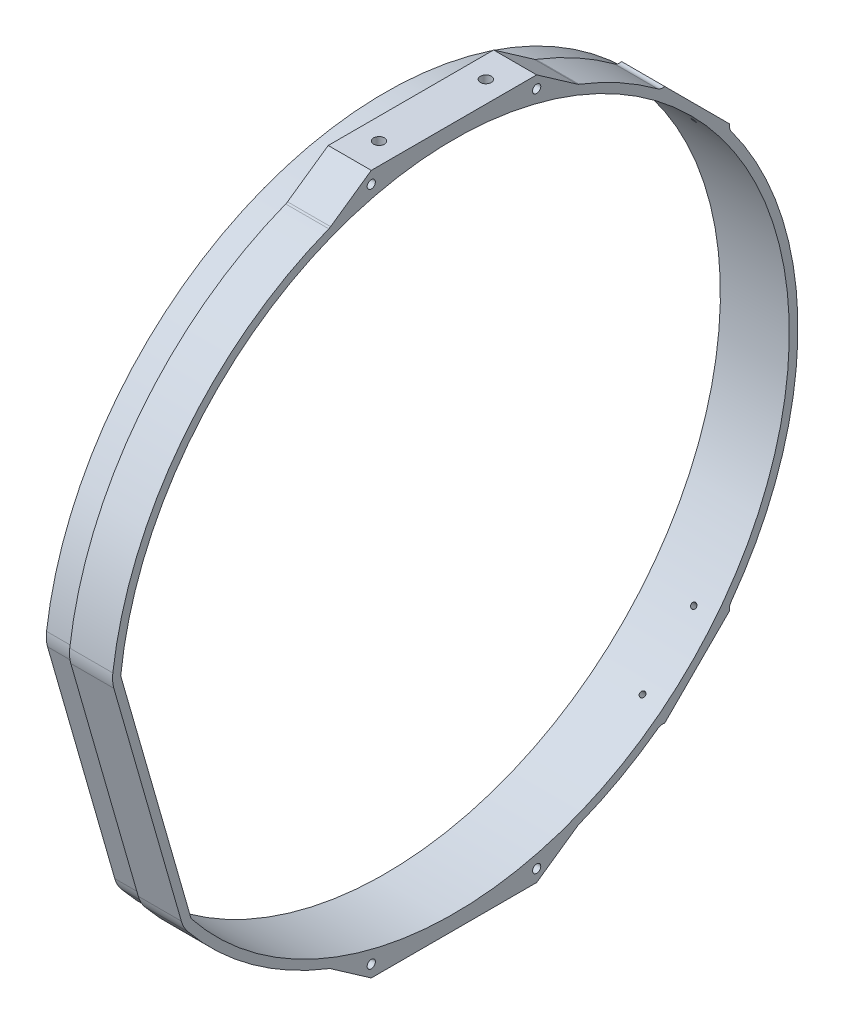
SolidWorks part; units mm, degrees
ref_plane "Front Plane" through (0, 0, 0) normal (0, 0, 1) x (1, 0, 0)
ref_plane "Top Plane" through (0, 0, 0) normal (0, 1, 0) x (1, 0, 0)
ref_plane "Right Plane" through (0, 0, 0) normal (1, 0, 0) x (0, 0, -1)
ref_plane "Plane1" through (0, 0, 0) normal (-1, 0, 0) x (0, -1, 0)
sketch "Sketch1" plane through (0, 0, 0) normal (-1, 0, 0) x (0, -1, 0)
  line L0 (-406, 0) -> (406, 0) construction
  line L1 (-320.0648, -244.6307) -> (-244.6307, -320.0648)
  line L2 (372.3363, -144.2434) -> (406, -96)
  line L3 (406, -96) -> (406, 96)
  line L4 (406, 96) -> (372.3363, 144.2434)
  line L5 (-372.3363, 144.2434) -> (-406, 96)
  line L6 (-406, 96) -> (-406, -96)
  line L7 (-406, -96) -> (-372.3363, -144.2434)
  line L8 (320.0648, -244.6307) -> (244.6307, -320.0648)
  line L9 (0, 0) -> (-282.3477, -282.3477) construction
  line L10 (0, 0) -> (282.3477, -282.3477) construction
  line L11 (0, 0) -> (99.2294, 346.0542) construction
  line L12 (246.3048, 314.284) -> (-42.3331, 397.0496)
  line L13 (241.6601, 305.2129) -> (-43.2012, 386.8955)
  line L14 (0, 0) -> (0, 450) construction
  arc A0 (320.0648, -244.6307) -> (321.7521, -236.4658) centre (329.81, -242.3878) cw
  arc A1 (321.7521, -236.4658) -> (372.3363, -144.2434) centre (0, 0) ccw
  arc A2 (372.3363, 144.2434) -> (246.3048, 314.284) centre (0, 0) ccw
  arc A3 (-372.3363, -144.2434) -> (-321.7521, -236.4658) centre (0, 0) ccw
  arc A4 (-321.7521, -236.4658) -> (-320.0648, -244.6307) centre (-329.81, -242.3878) cw
  arc A5 (-236.4658, -321.7521) -> (236.4658, -321.7521) centre (0, 0) ccw
  arc A6 (236.4658, -321.7521) -> (244.6307, -320.0648) centre (242.3878, -329.81) cw
  arc A7 (-244.6307, -320.0648) -> (-236.4658, -321.7521) centre (-242.3878, -329.81) cw
  arc A8 (-43.2012, 386.8955) -> (241.6601, 305.2129) centre (0, 0) ccw
  arc A9 (-42.3331, 397.0496) -> (-372.3363, 144.2434) centre (0, 0) ccw
  dimension "D9" = 10
  dimension "D8" = 399.3
  dimension "D10" = 10
  dimension "D17" = 399.3
  dimension "D18" = 10
  dimension "D19" = 10
  dimension "D20" = 10
  dimension "D1" = 812
  dimension "D2" = 192
  dimension "D3" = 192
  dimension "D4" = 145.093
  dimension "D5" = 145.093
  dimension "D6" = 145.093
  dimension "D7" = 145.093
  dimension "D11" = 106.68
  dimension "D12" = 106.68
  dimension "D13" = 45
  dimension "D14" = 45
  dimension "D15" = 399.3
  dimension "D16" = 399.3
  dimension "D21" = 450
  dimension "D22" = 16
  dimension "D23" = 10
  dimension "D24" = 360
extrude "Extrude1" add sketch "Sketch1" against normal blind 50
sketch "Sketch50" plane through (0, 282.3477, -282.3477) normal (0, 0.7071, -0.7071) x (1, 0, 0)
  line L0 (25, 53.34) -> (25, -53.34) construction
  line L1 (50, 53.34) -> (0, 53.34) construction
  line L2 (50, -53.34) -> (0, -53.34) construction
  line L3 (0, 0) -> (50, 0) construction
  line L4 (50, -53.34) -> (50, 53.34) construction
  circle A0 centre (25, 42) radius 3.175
  circle A1 centre (25, -42) radius 3.175
  dimension "D1" = 6.35
  dimension "D2" = 84
  dimension "D3" = 42
extrude "Extrude4" cut sketch "Sketch50" against normal blind 30
sketch "Sketch51" plane through (0, -282.3477, -282.3477) normal (0, -0.7071, -0.7071) x (1, 0, 0)
  line L0 (25, 53.34) -> (25, -53.34) construction
  line L1 (50, 53.34) -> (0, 53.34) construction
  line L2 (50, -53.34) -> (0, -53.34) construction
  line L3 (0, 0) -> (50, 0) construction
  line L4 (50, -53.34) -> (50, 53.34) construction
  circle A0 centre (25, 42) radius 3.175
  circle A1 centre (25, -42) radius 3.175
  dimension "D1" = 6.35
  dimension "D2" = 84
  dimension "D3" = 42
extrude "Extrude5" cut sketch "Sketch51" against normal blind 30
sketch "Sketch52" plane through (0, 0, 0) normal (-1, 0, 0) x (0, 0, 1)
  line L0 (305.2129, -241.6601) -> (386.8955, 43.2012) construction
  line L1 (305.2129, -241.6601) -> (386.8955, 43.2012)
  line L2 (311.5619, -244.9139) -> (394.0041, 42.5961)
  arc A1 (386.8955, 43.2012) -> (305.2129, -241.6601) centre (0, 0) ccw construction
  arc A2 (394.0041, 42.5961) -> (311.5619, -244.9139) centre (0, 0) ccw
  arc A3 (386.8955, 43.2012) -> (305.2129, -241.6601) centre (0, 0) ccw
  dimension "D1" = 7
extrude "Extrude6" add sketch "Sketch52" along normal blind 30
sketch "Sketch53" plane through (50, 0, 0) normal (1, 0, 0) x (0, 0, -1)
  line L0 (-96, 392) -> (96, 392) construction
  line L1 (-96, 406) -> (96, 406) construction
  line L2 (0, 406) -> (0, 389.3) construction
  line L3 (-96, -392) -> (96, -392) construction
  line L4 (0, -406) -> (0, -389.3) construction
  line L5 (96, -406) -> (-96, -406) construction
  circle A0 centre (-96, 392) radius 4.763
  circle A1 centre (96, 392) radius 4.763
  circle A2 centre (0, 0) radius 389.3 construction
  circle A3 centre (-96, -392) radius 4.763
  circle A4 centre (96, -392) radius 4.763
  dimension "D2" = 9.526
  dimension "D1" = 14
  dimension "D3" = 96
  dimension "D4" = 192
  dimension "D5" = 192
  dimension "D6" = 96
  dimension "D7" = 14
extrude "Extrude7" cut sketch "Sketch53" against normal through all
sketch "Sketch54" plane through (0, 406, 0) normal (0, 1, 0) x (1, 0, 0)
  line L0 (25, 62) -> (25, -62) construction
  line L1 (0, 0) -> (50, 0) construction
  line L2 (50, -96) -> (50, 96) construction
  circle A0 centre (25, 62) radius 6.35
  circle A1 centre (25, -62) radius 6.35
  dimension "D4" = 12.7
  dimension "D1" = 62
  dimension "D2" = 124
  dimension "D3" = 25
extrude "Extrude8" cut sketch "Sketch54" against normal blind 20
sketch "Sketch55" plane through (0, -406, 0) normal (0, -1, 0) x (1, 0, 0)
  line L0 (25, 62) -> (25, -62) construction
  line L1 (0, 0) -> (50, 0) construction
  line L2 (50, -96) -> (50, 96) construction
  circle A0 centre (25, 62) radius 6.35
  circle A1 centre (25, -62) radius 6.35
  dimension "D4" = 12.7
  dimension "D1" = 124
  dimension "D2" = 62
  dimension "D3" = 25
extrude "Extrude9" cut sketch "Sketch55" against normal blind 20
fillet "Fillet1" radius 10 4 edges at (25, 372.3363, -144.2434) (25, -372.3363, -144.2434) (25, -372.3363, 144.2434) (25, 372.3363, 144.2434)
fillet "Fillet2" radius 40 4 edges at (-15, 42.5961, 394.0041) (-15, -244.9139, 311.5619) (25, -246.3048, 314.284) (25, 42.3331, 397.0496)
